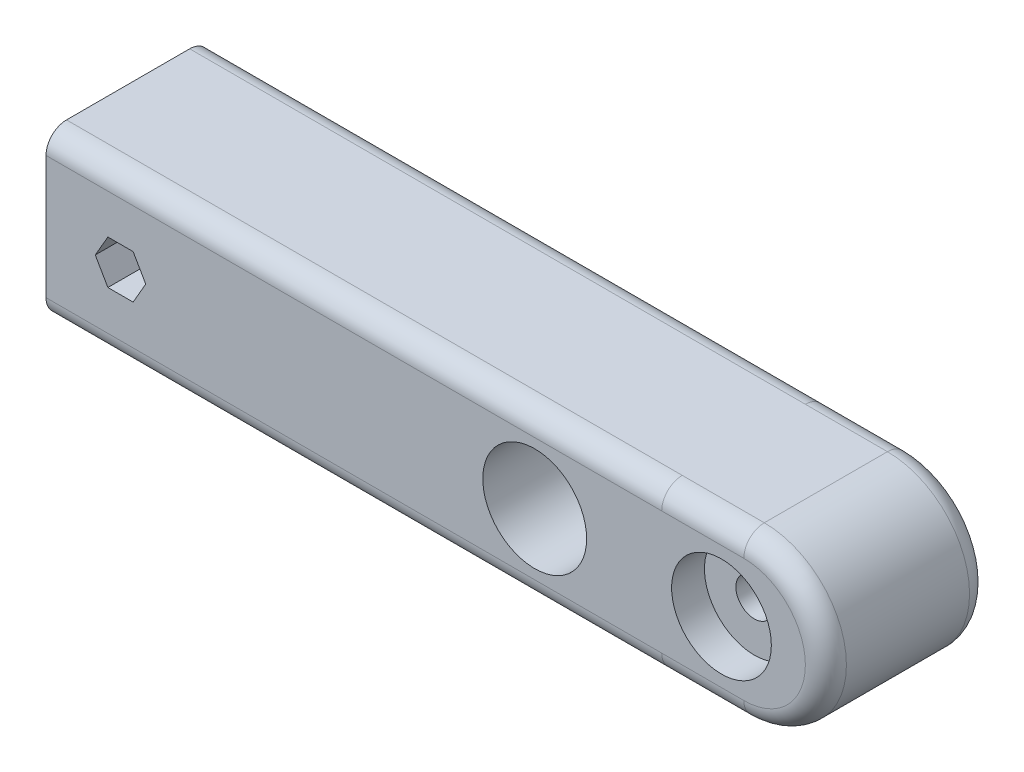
SolidWorks part; units mm, degrees
ref_plane "Alzado" through (0, 0, 0) normal (0, 0, 1) x (1, 0, 0)
ref_plane "Planta" through (0, 0, 0) normal (0, 1, 0) x (1, 0, 0)
ref_plane "Vista lateral" through (0, 0, 0) normal (1, 0, 0) x (0, 0, -1)
sketch "Croquis1" plane through (0, 0, 0) normal (0, 1, 0) x (1, 0, 0)
  line L1 (0, 0) -> (150, 0)
  line L2 (0, 0) -> (0, -40)
  line L3 (0, -40) -> (150, -40)
  line L4 (150, 0) -> (150, -40)
  dimension "D1" = 150
  dimension "D2" = 40
extrude "Saliente-Extruir1" add sketch "Croquis1" along normal blind 40
fillet "Redondeo2" radius 5 1 edges at (75, 0, 0)
fillet "Redondeo3" radius 5 3 edges at (75, 40, 0) (75, 40, 40) (75, 0, 40)
sketch "Croquis6" plane through (0, 0, 0) normal (0, 0, -1) x (-1, 0, 0)
  line L0 (0, 35) -> (0, 5) construction
  line L1 (-15.075, 14.6739) -> (-12, 20)
  line L2 (-12, 20) -> (-15.075, 25.3261)
  line L3 (-15.075, 25.3261) -> (-21.225, 25.3261)
  line L4 (-21.225, 25.3261) -> (-24.3, 20)
  line L5 (-24.3, 20) -> (-21.225, 14.6739)
  line L6 (-21.225, 14.6739) -> (-15.075, 14.6739)
  line L21 (0, 35) -> (-150, 35) construction
  circle A0 centre (-18.15, 20) radius 5.3261 construction
  dimension "D1" = 12.3
  dimension "D2" = 12
  dimension "D3" = 15
extrude "Cortar-Extruir2" cut sketch "Croquis6" against normal blind 86
sketch "Croquis7" plane through (0, 0, 40) normal (0, 0, 1) x (1, 0, 0)
  line L0 (150, 35) -> (0, 35) construction
  line L3 (150, 35) -> (150, 5) construction
  circle A0 centre (119.0584, 20) radius 12.65
  dimension "D1" = 25.3
  dimension "D2" = 15
  dimension "D3" = 30.9416
extrude "Cortar-Extruir4" cut sketch "Croquis7" against normal blind 72 contours A0
sketch "Croquis9" plane through (0, 0, 40) normal (0, 0, 1) x (1, 0, 0)
  line L0 (150, 35) -> (150, 40) construction
  line L1 (150, 40) -> (170, 40)
  line L2 (150, 40) -> (150, 0)
  line L3 (150, 0) -> (170, 0)
  arc A0 (170, 40) -> (170, 0) centre (170, 20) cw
  dimension "D1" = 20
extrude "Saliente-Extruir2" add sketch "Croquis9" against normal blind 40
fillet "Redondeo4" radius 5 6 edges at (160, 40, 0) (190, 20, 40) (190, 20, 0) (160, 0, 0) (160, 40, 40) (160, 0, 40)
sketch "Croquis10" plane through (0, 0, 40) normal (0, 0, 1) x (1, 0, 0)
  line L0 (170, 35) -> (150, 35) construction
  circle A0 centre (164.5635, 20) radius 4.5
  arc A1 (170, 5) -> (170, 35) centre (170, 20) ccw construction
  dimension "D1" = 9
  dimension "D3" = 5.4365
  dimension "D2" = 15
extrude "Cortar-Extruir5" cut sketch "Croquis10" against normal blind 60 contours A0
sketch "Croquis12" plane through (0, 0, 40) normal (0, 0, 1) x (1, 0, 0)
  circle A0 centre (164.5635, 20) radius 12.15
  dimension "D1" = 24.3
extrude "Cortar-Extruir6" cut sketch "Croquis12" against normal blind 8
sketch "Croquis13" plane through (0, 0, 0) normal (0, 0, -1) x (-1, 0, 0)
  circle A0 centre (-164.5635, 20) radius 12.15
  dimension "D1" = 24.3
extrude "Cortar-Extruir7" cut sketch "Croquis13" against normal blind 8 contours A0
sketch "Croquis14" plane through (0, 0, 0) normal (0, 0, -1) x (-1, 0, 0)
  circle A0 centre (-18.2099, 19.9408) radius 12.15
  dimension "D1" = 24.3
extrude "Cortar-Extruir8" cut sketch "Croquis14" against normal blind 8
